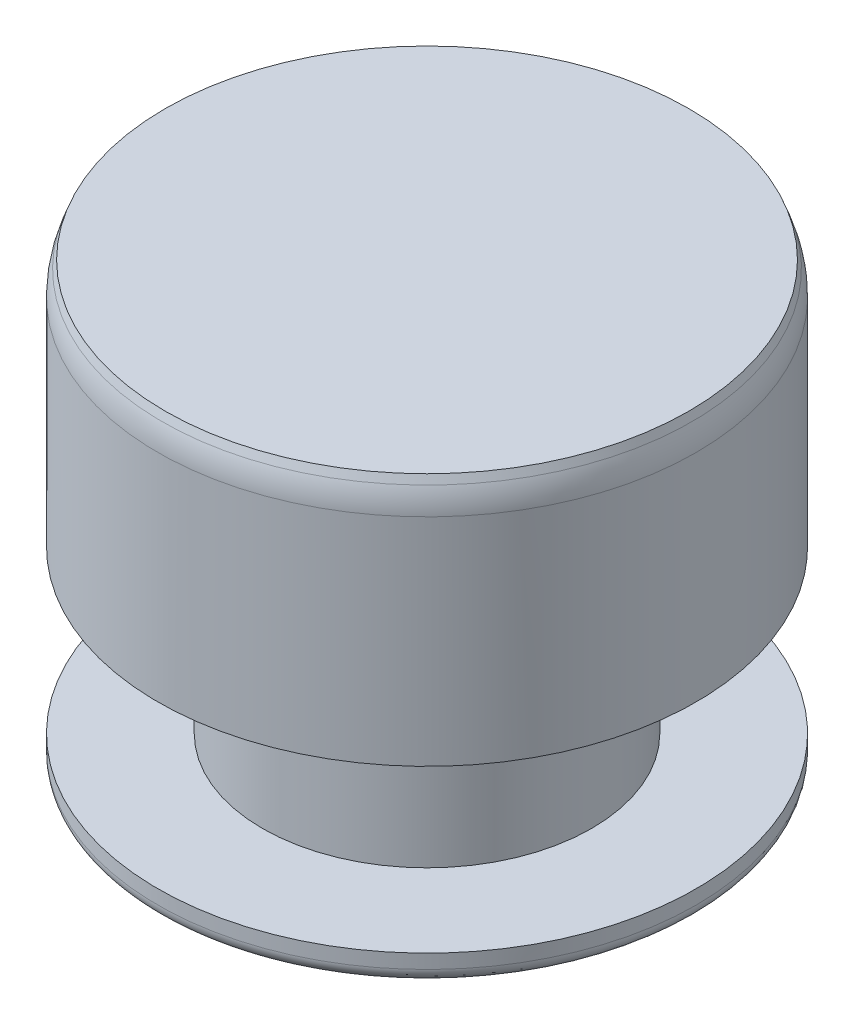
SolidWorks part; units mm, degrees
ref_plane "X_Y" through (0, 0, 0) normal (0, 0, 1) x (1, 0, 0)
ref_plane "Z_X" through (0, 0, 0) normal (0, 1, 0) x (1, 0, 0)
ref_plane "Y_Z" through (0, 0, 0) normal (1, 0, 0) x (0, 0, -1)
sketch "Sketch1" plane through (0, 0, 0) normal (0, 0, 1) x (1, 0, 0)
  line L0 (0, 0) -> (0, -7.9996)
  line L2 (0.5, -7.9996) -> (3.76, -6.0408)
  line L3 (3.76, -6.0408) -> (3.76, -5.73)
  line L4 (3.76, -5.73) -> (2.3, -5.73)
  line L5 (2.3, -5.73) -> (2.3, -3.47)
  line L6 (2.3, -3.47) -> (3.76, -3.47)
  line L7 (3.76, -3.47) -> (3.76, -0.2747)
  line L8 (3.66, 0) -> (0, 0)
  line L9 (0.5, -7.9996) -> (0, -7.9996)
  line L10 (3.66, 0) -> (3.76, -0.2747)
  line L11 (0, -0.5526) -> (0, -50000.5526) construction
  point P10 (0, -8.3)
  point P12 (2.3, -4.6)
  dimension "D1" = 6.0408
  dimension "D2" = 7.52
  dimension "D3" = 59
  dimension "D4" = 0.3108
  dimension "D5" = 2.26
  dimension "D6" = 4.6
  dimension "D7" = 0.5
  dimension "D8" = 0.1
  dimension "D9" = 20
  dimension "D10" = 8.3
  dimension "D11" = 4.6
revolve "Revolve1" add sketch "Sketch1" angle 360 about L0
fillet "Fillet1" radius 0.2 1 edges at (-3.76, -6.0408, 0)
fillet "Fillet2" radius 1 1 edges at (-3.76, -0.2747, 0)
